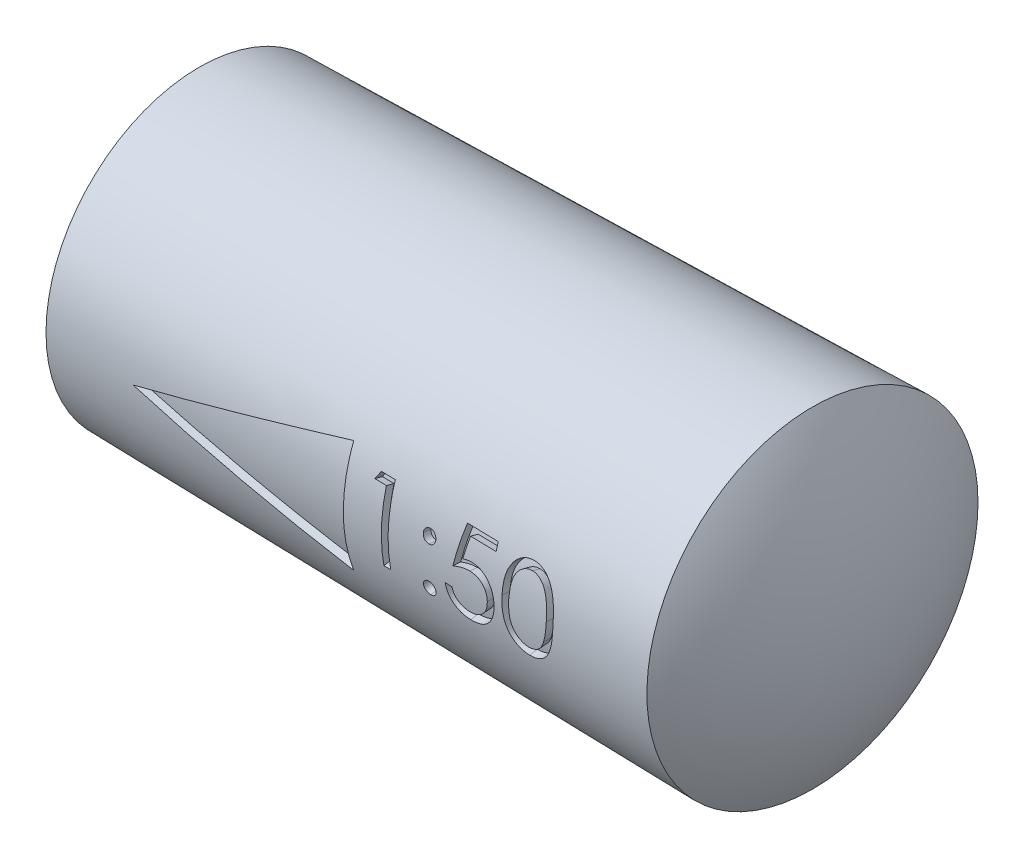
SolidWorks part; units mm, degrees
ref_plane "Front Plane" through (0, 0, 0) normal (0, 0, 1) x (1, 0, 0)
ref_plane "Top Plane" through (0, 0, 0) normal (0, 1, 0) x (1, 0, 0)
ref_plane "Right Plane" through (0, 0, 0) normal (1, 0, 0) x (0, 0, -1)
sketch "Sketch1" plane through (0, 0, 0) normal (1, 0, 0) x (0, 0, -1)
  circle A0 centre (0, 0) radius 2
  dimension "D1" = 4
extrude "Extrude1" add sketch "Sketch1" along normal mid plane 8
draft "Draft1" type of draft neutral plane draft angle 1.146 faces to draft 1 parameters "D1"=1.146
sketch "Sketch2" plane through (0, 0, 0) normal (0, 0, 1) x (1, 0, 0)
  line L0 (-4, 0) -> (-4, 2)
  line L1 (-4, 2) -> (-4, -2) construction
  line L2 (-4, 0) -> (-4.6, 0)
  line L3 (-4.6, 0) -> (-4.6, -2.08) construction
  line L4 (4, 0) -> (4, 2.16)
  line L5 (4, -2.16) -> (4, 2.16) construction
  line L6 (4, 0) -> (4.6, 0)
  line L7 (4.6, 0) -> (4.6, -2.08) construction
  line L8 (-4, -2) -> (4, -2.16) construction
  arc A0 (-4.6, 0) -> (-4, 2) centre (-0.9667, 0) cw
  arc A1 (4.6, 0) -> (4, 2.16) centre (0.412, 0) ccw
  point P14 (0, -2.08)
revolve "Revolve1" add sketch "Sketch2" angle 360 about L2
sketch "Sketch5" plane through (0, 0, 0) normal (0, 0, 1) x (1, 0, 0)
  line L0 (0, 2.08) -> (0, -2.08) construction
  line L1 (4, 2.16) -> (-4, 2) construction
  line L2 (-4, -2) -> (4, -2.16) construction
ref_plane "Plane2" through (0, 0, 0) normal (-0.02, 0, 0.9998) x (0.9998, 0, 0.02)
sketch "Sketch6" plane through (0, 0, 0) normal (-0.02, 0, 0.9998) x (0.9998, 0, 0.02)
  line L0 (0, 0) -> (0, 0.75)
  line L1 (0, 2.08) -> (0, -2.08) construction
  line L2 (0, 0.75) -> (-2.799, 0)
  line L3 (-2.799, 0) -> (0, -0.75)
  line L4 (0, -0.75) -> (0, 0)
  line L5 (0, -0.375) -> (3, -0.375) construction
  text T0 "1:50" font "Century Gothic" height 1
  dimension "D1" = 1.5
  dimension "D2" = 30
  dimension "D3" = 3
wrap "Wrap2" sketch "Sketch6" wrap type deboss source sketch "Sketch6" thickness 0.1 parameters "D1"=0.1
equation "\"D2@Sketch2\" = \"D1@Sketch2\""
